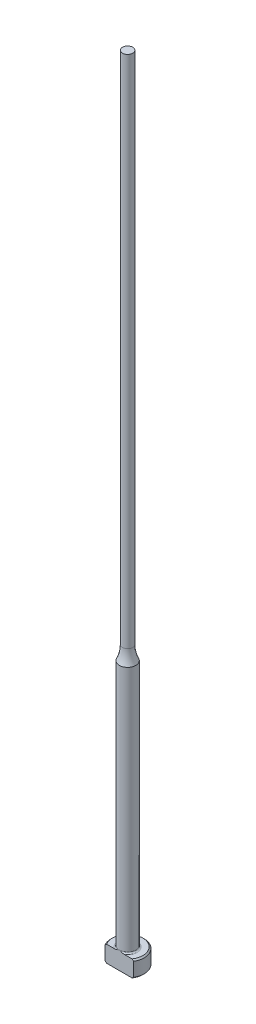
SolidWorks part; units mm, degrees
ref_plane "Front Plane" through (0, 0, 0) normal (0, 0, 1) x (1, 0, 0)
ref_plane "Top Plane" through (0, 0, 0) normal (0, 1, 0) x (1, 0, 0)
ref_plane "Right Plane" through (0, 0, 0) normal (1, 0, 0) x (0, 0, -1)
sketch "Sketch1" plane through (0, 0, 0) normal (0, 0, 1) x (1, 0, 0)
  line L0 (0, 259.9588) -> (0, -15.1925) construction
  line L1 (0, 0) -> (-3.175, 0)
  line L2 (-3.175, 0) -> (-3.175, 3.175)
  line L3 (-3.175, 3.175) -> (-1.5875, 3.175)
  line L4 (-0.9919, 53.4851) -> (-0.9919, 152.4)
  line L5 (-0.9919, 152.4) -> (0, 152.4)
  line L6 (0, 152.4) -> (0, 0)
  line L7 (-1.5875, 3.175) -> (-1.5875, 50.8)
  arc A0 (-1.5875, 50.8) -> (-0.9919, 53.4851) centre (-7.3419, 53.4851) ccw
  point P13 (-1.5875, 0)
  dimension "D1" = 6.35
  dimension "L" = 152.4
  dimension "D2" = 3.175
  dimension "H" = 6.35
  dimension "T" = 3.175
  dimension "D" = 1.9837
  dimension "S" = 50.8
revolve "Revolve1" add sketch "Sketch1" angle 360 about L0
chamfer "Chamfer1" distance 0.254 angle 45 2 edges at (0, 3.175, 3.175) (0, 0, 3.175)
fillet "Fillet1" radius 0.254 1 edges at (0, 3.175, 1.5875)
sketch "Sketch2" plane through (0, 0, 0) normal (0, -1, 0) x (1, 0, 0)
  line L0 (-2.7496, 1.5875) -> (2.7496, 1.5875)
  arc A0 (2.7496, 1.5875) -> (-2.7496, 1.5875) centre (0, 0) ccw
  circle A1 centre (0, 0) radius 3.175 construction
  circle A2 centre (0, 0) radius 1.5875 construction
extrude "Cut-Extrude1" cut sketch "Sketch2" against normal through all
